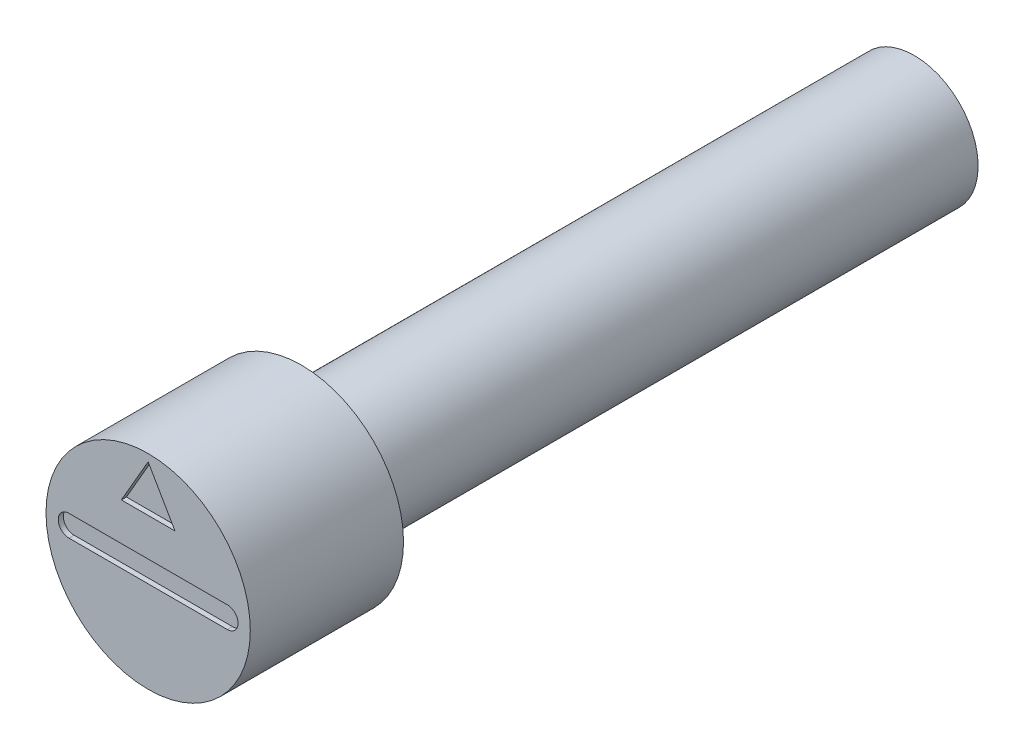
SolidWorks part; units mm, degrees
ref_plane "Front Plane" through (0, 0, 0) normal (0, 0, 1) x (1, 0, 0)
ref_plane "Top Plane" through (0, 0, 0) normal (0, 1, 0) x (1, 0, 0)
ref_plane "Right Plane" through (0, 0, 0) normal (1, 0, 0) x (0, 0, -1)
imported_body "Imported1"
other "DeleteFace1"
sketch "Sketch1" plane through (0, 0, 0) normal (0, 0, 1) x (1, 0, 0)
  line L0 (0, 1.8593) -> (-0.525, 0.95)
  line L1 (-0.525, 0.95) -> (0.525, 0.95)
  line L2 (0.525, 0.95) -> (0, 1.8593)
  line L4 (-1.55, 0.21) -> (1.55, 0.21)
  line L6 (-1.55, -0.21) -> (1.55, -0.21)
  arc A0 (-1.55, 0.21) -> (-1.55, -0.21) centre (-1.55, 0) ccw
  arc A1 (1.55, -0.21) -> (1.55, 0.21) centre (1.55, 0) ccw
  dimension "D6" = 3.52
  dimension "D1" = 1.05
  dimension "D2" = 60
  dimension "D3" = 60
  dimension "D4" = 0.42
  dimension "D5" = 0.21
  dimension "D7" = 1.76
  dimension "D8" = 0.74
extrude "Cut-Extrude1" cut sketch "Sketch1" against normal blind 0.1
